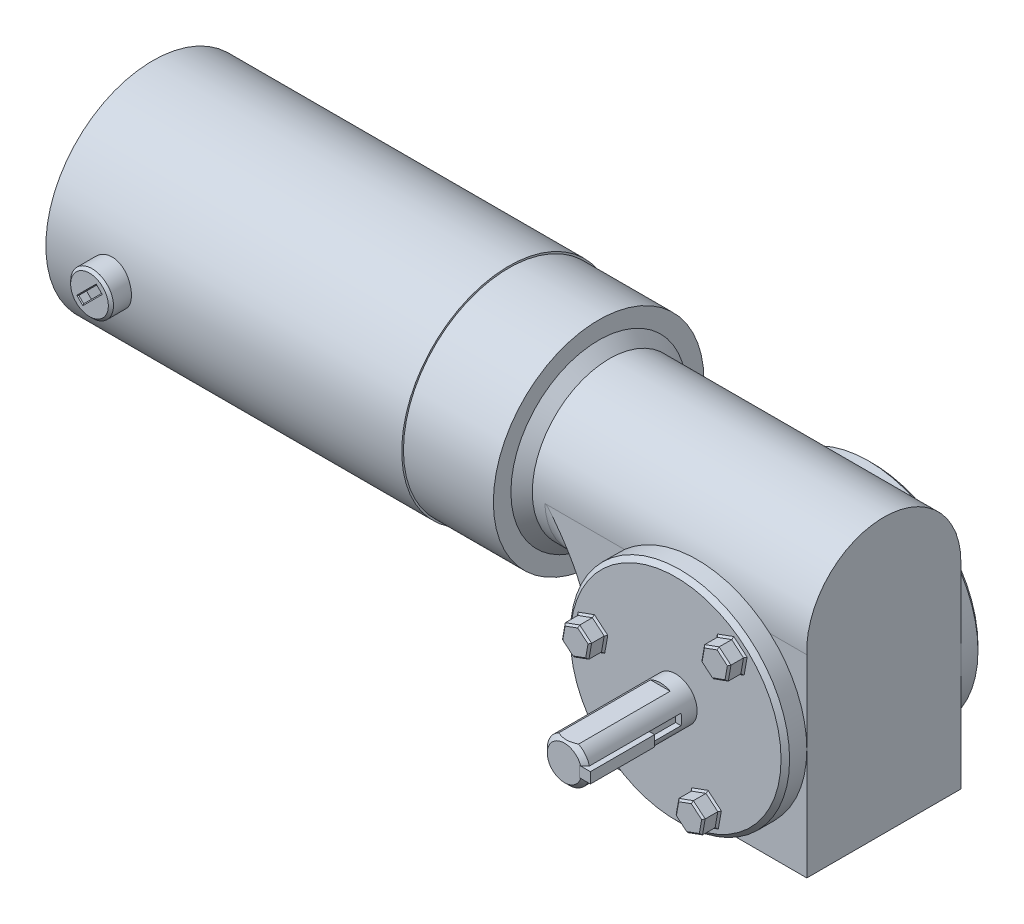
SolidWorks part; units mm, degrees
ref_plane "Front" through (0, 0, 0) normal (0, 0, 1) x (1, 0, 0)
ref_plane "Top" through (0, 0, 0) normal (0, 1, 0) x (1, 0, 0)
ref_plane "Right" through (0, 0, 0) normal (1, 0, 0) x (0, 0, -1)
sketch "Sketch1" plane through (0, 0, 0) normal (0, 0, 1) x (1, 0, 0)
  line L0 (40.4423, 0) -> (-186.7946, 0) construction
  line L1 (0, 0) -> (0, 31.242)
  line L2 (0, 31.242) -> (-19.05, 31.242)
  line L3 (-19.05, 31.242) -> (-19.05, 31.75)
  line L4 (-19.05, 31.75) -> (-124.6188, 31.75)
  line L5 (-124.6188, 31.75) -> (-124.6188, 22.225)
  line L6 (-124.6188, 22.225) -> (-130.9688, 22.225)
  line L7 (-130.9688, 22.225) -> (-130.9688, 0)
  line L8 (-130.9688, 0) -> (0, 0)
  dimension "D1" = 44.45
  dimension "P" = 63.5
  dimension "D2" = 6.35
  dimension "XH" = 130.9688
  dimension "D3" = 19.05
  dimension "D4" = 0.508
revolve "Revolve1" add sketch "Sketch1" angle 360 about L0
chamfer "Chamfer1" distance 3.175 angle 45 1 edges at (-130.9688, 0, -22.225)
ref_plane "Plane1" through (0, 0, 62.23) normal (0, 0, 1) x (1, 0, 0)
sketch "Sketch3" plane through (0, 0, 62.23) normal (0, 0, 1) x (1, 0, 0)
  line L0 (0, -31.242) -> (0, 31.242) construction
  circle A0 centre (59.69, -25.4) radius 6.35
  dimension "D1" = 59.69
  dimension "D3" = 12.7
  dimension "D2" = 25.4
extrude "Extrude1" add sketch "Sketch3" against normal up to surface (62.23 mm away)
sketch "Sketch4" plane through (0, 0, 62.23) normal (0, 0, 1) x (1, 0, 0)
  line L0 (66.04, -23.7871) -> (64.1985, -23.7871)
  line L1 (56.77, -19.05) -> (62.61, -19.05)
  line L2 (56.77, -19.05) -> (56.77, -19.7612)
  line L3 (56.77, -19.7612) -> (62.61, -19.7612)
  line L4 (62.61, -19.05) -> (62.61, -19.7612)
  line L5 (64.1985, -23.7871) -> (64.1985, -27.0129)
  line L6 (64.1985, -27.0129) -> (66.04, -27.0129)
  line L7 (66.04, -23.7871) -> (66.04, -27.0129)
  line L8 (59.69, -25.4) -> (64.1985, -25.4) construction
  circle A0 centre (59.69, -25.4) radius 6.35 construction
  dimension "D1" = 11.9888
  dimension "D2" = 10.8585
  dimension "D3" = 3.2258
extrude "Cut-Extrude1" cut sketch "Sketch4" against normal blind 28.448
chamfer "Chamfer6" distance 1.27 angle 45 1 edges at (64.6479, -21.4324, 62.23)
ref_plane "Plane2" through (0, 0, 29.21) normal (0, 0, 1) x (1, 0, 0)
sketch "Sketch5" plane through (0, 0, 29.21) normal (0, 0, 1) x (1, 0, 0)
  line L0 (0, -31.242) -> (0, 31.242) construction
  circle A0 centre (59.69, -25.4) radius 32.512
  arc A1 (62.61, -19.7612) -> (53.5483, -27.0129) centre (59.69, -25.4) ccw construction
  dimension "X" = 92.202
extrude "Extrude2" add sketch "Sketch5" against normal blind 6.3754
sketch "Sketch6" plane through (0, 0, 0) normal (0, 0, 1) x (1, 0, 0)
  line L0 (0, 31.242) -> (7.62, 31.242)
  line L1 (7.62, 31.242) -> (7.62, 22.86)
  line L2 (7.62, 22.86) -> (92.202, 22.86)
  line L4 (92.202, 22.86) -> (92.202, 0)
  line L5 (0, 0) -> (92.202, 0)
  line L6 (106.6498, 0) -> (-35.6571, 0) construction
  line L9 (0, 0) -> (0, 31.242)
  line L10 (0, -31.242) -> (0, 31.242) construction
  line L14 (0, 31.242) -> (-19.05, 31.242) construction
  circle A0 centre (59.69, -25.4) radius 32.512 construction
  dimension "D1" = 7.62
  dimension "D2" = 45.72
revolve "Revolve6" add sketch "Sketch6" angle 360 about L6
ref_plane "Plane3" through (0, -58.42, 0) normal (0, 1, 0) x (-1, 0, 0)
sketch "Sketch7" plane through (0, -58.42, 0) normal (0, 1, 0) x (-1, 0, 0)
  line L0 (-92.202, 22.8346) -> (-27.178, 22.8346)
  line L2 (-27.178, 22.8346) -> (-27.178, -22.86)
  line L4 (-27.178, -22.86) -> (-92.202, -22.86)
  line L5 (-92.202, -22.86) -> (-92.202, 22.8346)
  line L9 (-27.178, 22.8346) -> (-27.178, 29.21) construction
  line L10 (-92.202, 29.21) -> (-92.202, 22.8346) construction
  line L11 (-78.5575, 22.8346) -> (-40.8225, 22.8346) construction
  line L12 (-92.202, -22.86) -> (-7.62, -22.86) construction
extrude "Extrude3" add sketch "Sketch7" along normal up to surface (58.42 mm away)
fillet "Fillet1" radius 12.7 1 edges at (27.178, -22.8536, -0.5388)
chamfer "Chamfer2" distance 3.175 angle 45 1 edges at (7.62, 0, -22.86)
mirror "Mirror1" about plane through (0, 0, 0) normal (0, 0, 1) of "Extrude2"
sketch "Sketch8" plane through (0, 0, 62.23) normal (0, 0, 1) x (1, 0, 0)
  line L0 (64.1985, -23.7871) -> (64.1985, -27.0129) construction
  line L1 (64.2239, -23.8125) -> (67.3989, -23.8125)
  line L2 (64.2239, -23.8125) -> (64.2239, -26.9875)
  line L3 (64.2239, -26.9875) -> (67.3989, -26.9875)
  line L4 (67.3989, -23.8125) -> (67.3989, -26.9875)
  line L5 (64.1985, -27.0129) -> (64.5072, -27.0129) construction
  line L6 (64.5072, -23.7871) -> (64.1985, -23.7871) construction
  dimension "D1" = 0.0254
  dimension "D2" = 0.0254
  dimension "D3" = 0.0254
extrude "Extrude4" add sketch "Sketch8" against normal blind 19.05
sketch "Sketch9" plane through (0, 0, 0) normal (0, 0, 1) x (1, 0, 0)
  line L0 (-130.9688, 19.05) -> (-130.9688, -19.05) construction
  circle A0 centre (-105.5687, 0) radius 6.35
  dimension "D1" = 12.7
  dimension "D2" = 25.4
extrude "Extrude5" add sketch "Sketch9" along normal mid plane 75.692
chamfer "Chamfer3" distance 0.762 angle 45 2 edges at (-99.2188, 0, -37.846) (-99.2188, 0, 37.846)
sketch "Sketch10" plane through (0, 0, 37.846) normal (0, 0, 1) x (1, 0, 0)
  line L0 (-108.9812, -1.9757) -> (-103.5931, 3.4125)
  line L1 (-103.5931, 3.4125) -> (-102.1563, 1.9757)
  line L2 (-102.1563, 1.9757) -> (-107.5444, -3.4125)
  line L3 (-107.5444, -3.4125) -> (-108.9812, -1.9757)
  line L4 (-107.0056, 0) -> (-104.1319, 0) construction
  line L5 (40.4423, 0) -> (-186.7946, 0) construction
  line L6 (-107.5444, -3.4125) -> (-103.5931, 3.4125) construction
  point P8 (-105.5687, 0)
  dimension "D1" = 2.032
  dimension "D2" = 7.62
  dimension "D3" = 45
extrude "Cut-Extrude2" cut sketch "Sketch10" against normal blind 2.54
mirror "Mirror5" about plane through (0, 0, 0) normal (0, 0, 1) of "Cut-Extrude2"
chamfer "Chamfer4" distance 0.254 angle 45 8 edges at (-102.8747, 2.6941, 37.846) (-104.8503, -0.7184, 37.846) (-108.2628, -2.6941, 37.846) (-106.2872, 0.7184, 37.846) (-108.2628, -2.6941, -37.846) (-106.2872, 0.7184, -37.846) (-102.8747, 2.6941, -37.846) (-104.8503, -0.7184, -37.846)
sketch "Sketch13" plane through (0, 0, 29.21) normal (0, 0, 1) x (1, 0, 0)
  line L0 (68.3773, -49.2682) -> (59.69, -25.4) construction
  line L1 (71.8823, -52.2092) -> (72.6768, -47.7033)
  line L2 (72.6768, -47.7033) -> (69.1718, -44.7623)
  line L3 (69.1718, -44.7623) -> (64.8724, -46.3272)
  line L4 (64.8724, -46.3272) -> (64.0779, -50.8331)
  line L5 (64.0779, -50.8331) -> (67.5828, -53.7741)
  line L6 (67.5828, -53.7741) -> (71.8823, -52.2092)
  line L7 (59.69, -25.4) -> (59.69, -40.3034) construction
  circle A0 centre (68.3773, -49.2682) radius 3.9624 construction
  dimension "D1" = 20
  dimension "D2" = 7.9248
  dimension "D3" = 25.4
extrude "Extrude6" add sketch "Sketch13" along normal blind 4.7498
chamfer "Chamfer5" distance 0.508 angle 45 12 edges at (65.8303, -52.3036, 33.9598) (64.4751, -48.5801, 33.9598) (67.0221, -45.5448, 33.9598) (70.9243, -46.2328, 33.9598) (72.2795, -49.9563, 33.9598) (69.7325, -52.9916, 33.9598) (69.7325, -52.9916, 29.21) (65.8303, -52.3036, 29.21) (64.4751, -48.5801, 29.21) (67.0221, -45.5448, 29.21) (72.2795, -49.9563, 29.21) (70.9243, -46.2328, 29.21)
pattern_circular "CirPattern2" count 3 over 360 about axis through (59.69, -25.4, 0) along (0, 0, 1) of "Chamfer5", "Extrude6"
mirror "Mirror6" about plane through (0, 0, 0) normal (0, 0, 1) of "CirPattern2", "Extrude6", "Chamfer5"
ref_plane "Plane4" through (0, 0, 15.113) normal (0, 0, 1) x (1, 0, 0)
sketch "Sketch14" plane through (0, 0, 15.113) normal (0, 0, 1) x (1, 0, 0)
  line L0 (85.09, -39.37) -> (82.6024, -42.2316)
  line L1 (82.6024, -42.2316) -> (82.6024, -42.5491)
  line L2 (82.6024, -42.5491) -> (81.915, -42.946)
  line L3 (81.915, -42.946) -> (81.915, -43.1048)
  line L4 (81.915, -43.1048) -> (82.6024, -43.5016)
  line L5 (85.09, -39.37) -> (85.09, -58.7416)
  line L6 (85.09, -33.9852) -> (85.09, -60.1153) construction
  line L7 (27.178, -58.42) -> (92.202, -58.42) construction
  line L8 (82.6024, -42.5491) -> (82.6024, -43.5016) construction
  line L9 (82.6024, -43.0254) -> (81.915, -43.0254) construction
  line L10 (59.69, -16.5954) -> (59.69, -33.9828) construction
  line L11 (82.6024, -43.5016) -> (82.6024, -43.8191)
  line L12 (82.6024, -43.8191) -> (81.915, -44.216)
  line L13 (81.915, -44.216) -> (81.915, -44.3748)
  line L14 (81.915, -44.3748) -> (82.6024, -44.7716)
  line L15 (82.6024, -44.7716) -> (82.6024, -45.0891)
  line L16 (82.6024, -45.0891) -> (81.915, -45.486)
  line L17 (81.915, -45.486) -> (81.915, -45.6448)
  line L18 (81.915, -45.6448) -> (82.6024, -46.0416)
  line L19 (82.6024, -46.0416) -> (82.6024, -46.3591)
  line L20 (82.6024, -46.3591) -> (81.915, -46.756)
  line L21 (81.915, -46.756) -> (81.915, -46.9148)
  line L22 (81.915, -46.9148) -> (82.6024, -47.3116)
  line L23 (82.6024, -47.3116) -> (82.6024, -47.6291)
  line L24 (82.6024, -47.6291) -> (81.915, -48.026)
  line L25 (81.915, -48.026) -> (81.915, -48.1848)
  line L26 (81.915, -48.1848) -> (82.6024, -48.5816)
  line L27 (82.6024, -48.5816) -> (82.6024, -48.8991)
  line L28 (82.6024, -48.8991) -> (81.915, -49.296)
  line L29 (81.915, -49.296) -> (81.915, -49.4548)
  line L30 (81.915, -49.4548) -> (82.6024, -49.8516)
  line L31 (82.6024, -49.8516) -> (82.6024, -50.1691)
  line L32 (82.6024, -50.1691) -> (81.915, -50.566)
  line L33 (81.915, -50.566) -> (81.915, -50.7248)
  line L34 (81.915, -50.7248) -> (82.6024, -51.1216)
  line L35 (82.6024, -51.1216) -> (82.6024, -51.4391)
  line L36 (82.6024, -51.4391) -> (81.915, -51.836)
  line L37 (81.915, -51.836) -> (81.915, -51.9948)
  line L38 (81.915, -51.9948) -> (82.6024, -52.3916)
  line L39 (82.6024, -52.3916) -> (82.6024, -52.7091)
  line L40 (82.6024, -52.7091) -> (81.915, -53.106)
  line L41 (81.915, -53.106) -> (81.915, -53.2648)
  line L42 (81.915, -53.2648) -> (82.6024, -53.6616)
  line L43 (82.6024, -53.6616) -> (82.6024, -53.9791)
  line L44 (82.6024, -53.9791) -> (81.915, -54.376)
  line L45 (81.915, -54.376) -> (81.915, -54.5348)
  line L46 (81.915, -54.5348) -> (82.6024, -54.9316)
  line L47 (82.6024, -54.9316) -> (82.6024, -55.2491)
  line L48 (82.6024, -55.2491) -> (81.915, -55.646)
  line L49 (81.915, -55.646) -> (81.915, -55.8048)
  line L50 (81.915, -55.8048) -> (82.6024, -56.2016)
  line L51 (82.6024, -56.2016) -> (82.6024, -56.5191)
  line L52 (82.6024, -56.5191) -> (81.915, -56.916)
  line L53 (81.915, -56.916) -> (81.915, -57.0748)
  line L54 (81.915, -57.0748) -> (82.6024, -57.4716)
  line L55 (82.6024, -57.4716) -> (82.6024, -57.7891)
  line L56 (82.6024, -57.7891) -> (81.915, -58.186)
  line L57 (81.915, -58.186) -> (81.915, -58.3448)
  line L58 (81.915, -58.3448) -> (82.6024, -58.7416)
  line L59 (82.6024, -58.7416) -> (85.09, -58.7416)
  dimension "D1" = 19.05
  dimension "D2" = 6.35
  dimension "D3" = 1.27
  dimension "D4" = 0.3175
  dimension "D5" = 0.1588
  dimension "D6" = 60
  dimension "D7" = 41
  dimension "D8" = 50.8
revolve "Cut-Revolve2" cut sketch "Sketch14" angle 360 about L6
pattern_linear "LPattern1" count 2 spacing 50.8 along (-1, 0, 0) count 2 spacing 30.226 along (0, 0, -1) of "Cut-Revolve2"
chamfer "Chamfer7" distance 1.27 angle 45 2 edges at (92.202, -25.4, 29.21) (92.202, -25.4, -29.21)
